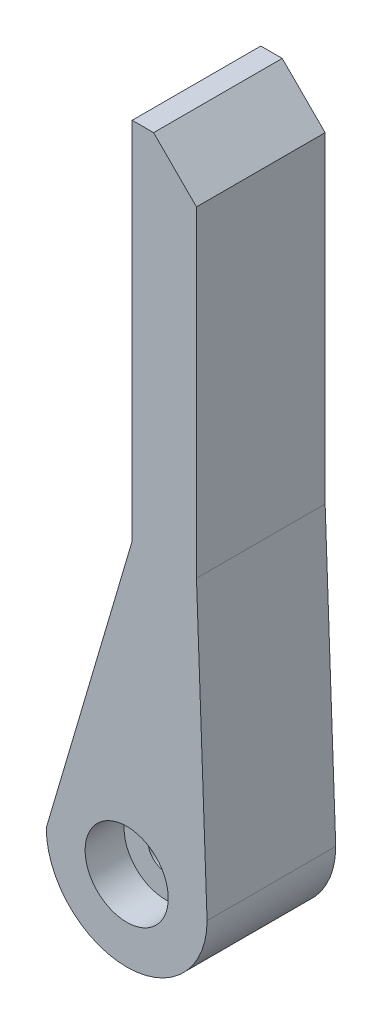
SolidWorks part; units mm, degrees
ref_plane "Front Plane" through (0, 0, 0) normal (0, 0, 1) x (1, 0, 0)
ref_plane "Top Plane" through (0, 0, 0) normal (0, 1, 0) x (1, 0, 0)
ref_plane "Right Plane" through (0, 0, 0) normal (1, 0, 0) x (0, 0, -1)
ref_plane "Plane1" through (0, 0, 17.78) normal (0, 0, 1) x (1, 0, 0)
sketch "Sketch1" plane through (0, 0, 17.78) normal (0, 0, 1) x (1, 0, 0)
  line L0 (-9.906, 26.67) -> (-9.906, 45.72)
  line L1 (-9.906, 45.72) -> (-12.446, 48.26)
  line L2 (-12.446, 48.26) -> (-13.716, 48.26)
  line L3 (-13.716, 48.26) -> (-13.716, 26.67)
  line L4 (-13.716, 26.67) -> (-18.8035, 9.42)
  line L5 (-9.2785, 9.42) -> (-9.906, 26.67)
  arc A0 (-18.8035, 9.42) -> (-9.2785, 9.42) centre (-14.041, 9.42) ccw
  dimension "D1" = 4.7625
  dimension "D2" = 9.906
  dimension "D3" = 12.446
  dimension "D4" = 13.716
  dimension "D5" = 14.041
  dimension "D6" = 9.42
  dimension "D7" = 26.67
  dimension "D8" = 45.72
  dimension "D9" = 48.26
extrude "Boss-Extrude1" add sketch "Sketch1" against normal blind 7.62
ref_plane "Plane2" through (0, 9.42, 0) normal (0, -1, 0) x (1, 0, 0)
sketch "Sketch2" plane through (0, 9.42, 0) normal (0, -1, 0) x (1, 0, 0)
  line L0 (-11.5772, 17.78) -> (-14.041, 17.78)
  line L1 (-14.041, 17.78) -> (-14.041, 10.16)
  line L2 (-14.041, 10.16) -> (-11.5772, 10.16)
  line L3 (-11.5772, 10.16) -> (-11.5772, 12.9338)
  line L4 (-11.5772, 12.9338) -> (-12.9996, 12.9338)
  line L5 (-12.9996, 12.9338) -> (-12.9996, 15.4738)
  line L6 (-12.9996, 15.4738) -> (-11.5772, 15.4738)
  line L7 (-11.5772, 15.4738) -> (-11.5772, 17.78)
  line L8 (-14.041, 17.78) -> (-14.041, 10.16) construction
  dimension "D1" = 11.5772
  dimension "D2" = 12.9996
  dimension "D3" = 14.041
  dimension "D4" = 10.16
  dimension "D5" = 12.9338
  dimension "D6" = 15.4738
  dimension "D7" = 17.78
revolve "Cut-Revolve1" cut sketch "Sketch2" angle 360 about L8
